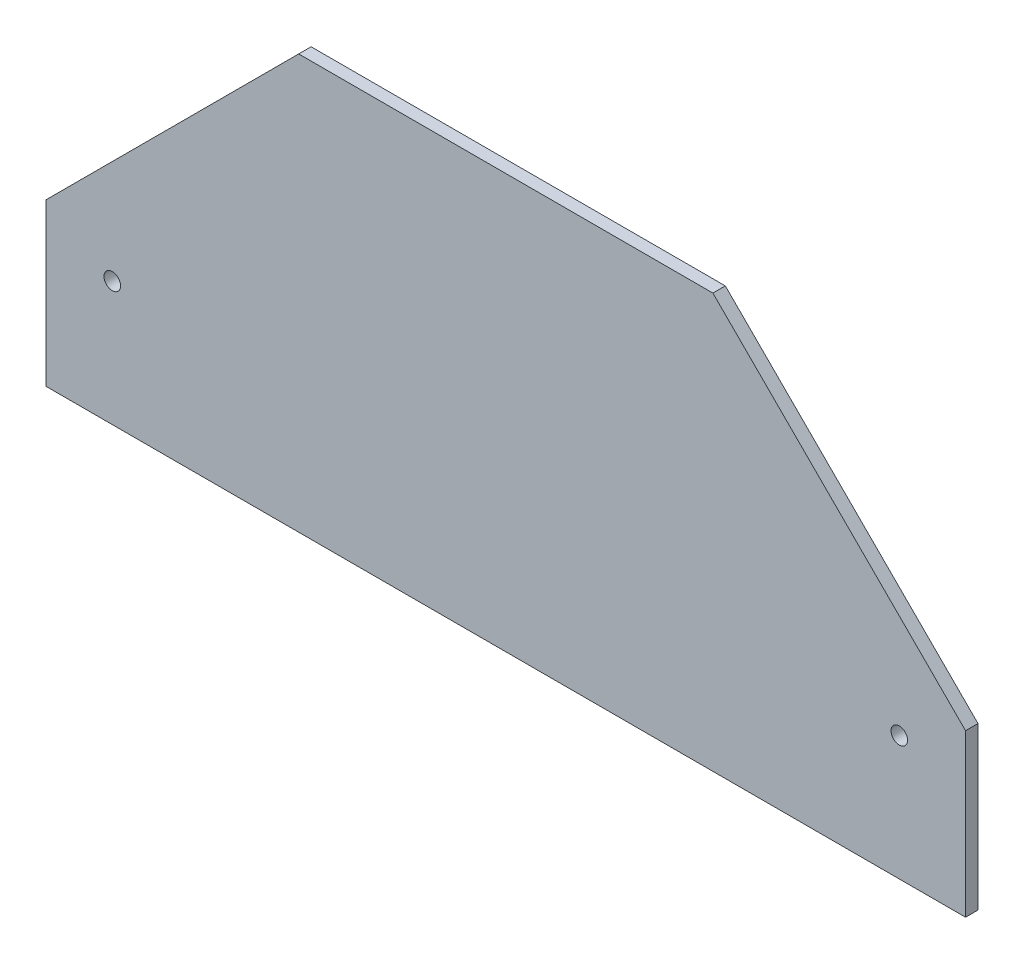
SolidWorks part; units mm, degrees
ref_plane "Front Plane" through (0, 0, 0) normal (0, 0, 1) x (1, 0, 0)
ref_plane "Top Plane" through (0, 0, 0) normal (0, 1, 0) x (1, 0, 0)
ref_plane "Right Plane" through (0, 0, 0) normal (1, 0, 0) x (0, 0, -1)
sketch "Sketch1" plane through (0, 0, 0) normal (0, 0, 1) x (1, 0, 0)
  line L0 (0, 0) -> (0, -100) construction
  line L1 (-555, -250) -> (555, -250)
  line L2 (-555, -250) -> (-555, 250)
  line L3 (-555, 250) -> (555, 250)
  line L4 (555, -250) -> (555, 250)
  line L5 (-555, -250) -> (555, 250) construction
  line L6 (-555, 250) -> (555, -250) construction
  line L7 (-475, -100) -> (475, -100) construction
  circle A0 centre (-475, -100) radius 10
  circle A1 centre (475, -100) radius 10
  point P0 (0, 0)
  point P11 (0, -100)
  dimension "D5" = 20
  dimension "D6" = 20
  dimension "D1" = 1110
  dimension "D2" = 500
  dimension "D3" = 100
  dimension "D4" = 950
extrude "Boss-Extrude1" add sketch "Sketch1" along normal blind 15
sketch "Sketch2" plane through (0, 0, 0) normal (0, 0, 1) x (1, 0, 0)
  line L0 (-555, -250) -> (-555, -55)
  line L1 (-555, 250) -> (-555, -250) construction
  line L2 (-555, -55) -> (-250, 250)
  line L3 (555, 250) -> (-555, 250) construction
  line L4 (-250, 250) -> (250, 250)
  line L5 (250, 250) -> (555, -55)
  line L6 (555, -250) -> (555, 250) construction
  line L7 (555, -55) -> (555, -250)
  line L8 (555, -250) -> (-555, -250)
  point P5 (0, -250)
  point P15 (0, 250)
  dimension "D1" = 500
  dimension "D2" = 135
  dimension "D3" = 135
extrude "Cut-Extrude1" cut sketch "Sketch2" along normal through all flip side to cut
